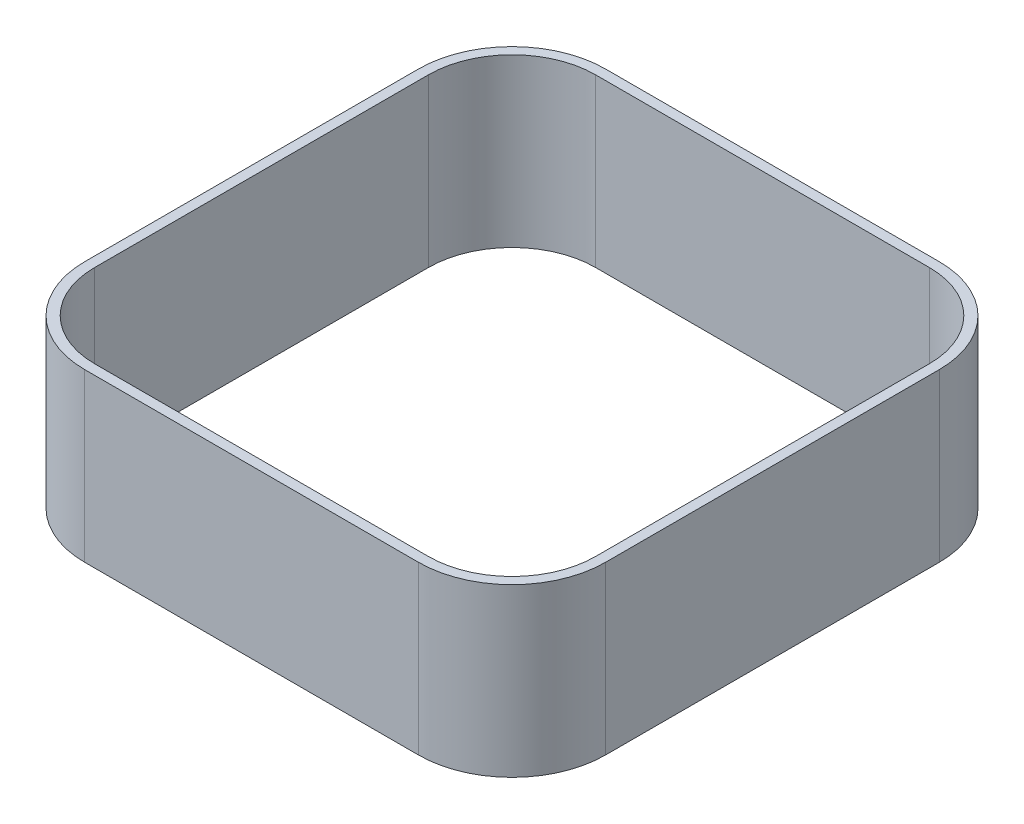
SolidWorks part; units mm, degrees
ref_plane "Alzado" through (0, 0, 0) normal (0, 0, 1) x (1, 0, 0)
ref_plane "Planta" through (0, 0, 0) normal (0, 1, 0) x (1, 0, 0)
ref_plane "Vista lateral" through (0, 0, 0) normal (1, 0, 0) x (0, 0, -1)
sketch "Croquis1" plane through (0, 0, 0) normal (0, 1, 0) x (1, 0, 0)
  line L1 (-10, -15) -> (10, -15)
  line L2 (-15, -10) -> (-15, 10)
  line L3 (-10, 15) -> (10, 15)
  line L4 (15, -10) -> (15, 10)
  line L5 (-15, -15) -> (15, 15) construction
  line L6 (-15, 15) -> (15, -15) construction
  line L10 (-15.6, -10) -> (-15.6, 10)
  line L11 (-10, 15.6) -> (10, 15.6)
  line L12 (15.6, -10) -> (15.6, 10)
  line L13 (-10, -15.6) -> (10, -15.6)
  arc A0 (-10, -15) -> (-15, -10) centre (-10, -10) cw
  arc A1 (10, -15) -> (15, -10) centre (10, -10) ccw
  arc A2 (10, 15) -> (15, 10) centre (10, 10) cw
  arc A3 (-15, 10) -> (-10, 15) centre (-10, 10) cw
  arc A4 (-15.6, 10) -> (-10, 15.6) centre (-10, 10) cw
  arc A5 (10, 15.6) -> (15.6, 10) centre (10, 10) cw
  arc A6 (10, -15.6) -> (15.6, -10) centre (10, -10) ccw
  arc A7 (-10, -15.6) -> (-15.6, -10) centre (-10, -10) cw
  point P0 (0, 0)
  dimension "D2" = 5
  dimension "D1" = 30
  dimension "D3" = 0.6
extrude "Saliente-Extruir1" add sketch "Croquis1" along normal blind 10
